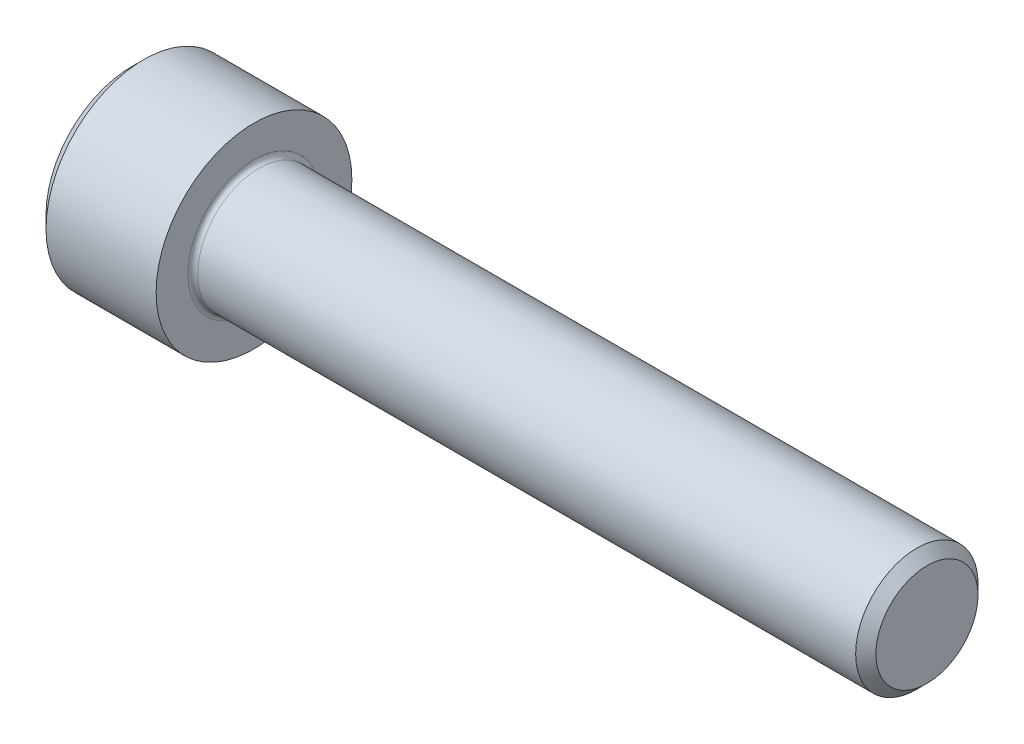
SolidWorks part; units mm, degrees
ref_plane "Plane1" through (0, 0, 0) normal (0, 0, 1) x (1, 0, 0)
ref_plane "Plane2" through (0, 0, 0) normal (0, 1, 0) x (1, 0, 0)
ref_plane "Plane3" through (0, 0, 0) normal (1, 0, 0) x (0, 0, -1)
revolve "Base-Revolve" add sketch "BodySke"
sketch "BodySke" plane through (0, 0, 0) normal (0, 0, 1) x (1, 0, 0)
  line L0 (0, 0) -> (0, 7)
  line L1 (1, 8) -> (10, 8)
  line L2 (10, 8) -> (10, 5)
  line L3 (10, 5) -> (64.172, 5)
  line L4 (65, 4.172) -> (65, 0)
  line L5 (65, 0) -> (0, 0)
  line L6 (-31.75, 0) -> (127, 0) construction
  line L7 (0, 7) -> (1, 8)
  line L8 (65, 4.172) -> (64.172, 5)
  line L9 (0, -7) -> (1, -8) construction
  line L10 (65, -4.172) -> (64.172, -5) construction
  line L11 (11.5, 9.525) -> (11.5, 3.175) construction
  line L12 (33, 9.525) -> (33, 3.175) construction
  line L13 (15, 9.525) -> (15, 3.175) construction
  dimension "Diameter" = 10
  dimension "Head_ht" = 10
  dimension "Length" = 55
  dimension "Body_ch_ang" = 45
  dimension "Head_dia" = 16
  dimension "Head_ch_ang" = 45
  dimension "Minor_dia" = 8.344
  dimension "Advance" = 1.5
  dimension "Thread_nom" = 32
  dimension "Thread_length" = 50
  dimension "Head_ch_ht" = 1
fillet "Fillet1" radius 0.4 1 edges at (10, 0, 5)
sketch "Sketch2" plane through (0, 0, 0) normal (0, 0, 1) x (1, 0, 0)
  line L0 (0, 4.0575) -> (5, 4.0575)
  line L1 (5, 4.0575) -> (7.3426, 0)
  line L2 (-31.75, 0) -> (127, 0) construction
  line L3 (7.3426, 0) -> (0, 0)
  line L4 (0, 0) -> (0, 4.0575)
  line L5 (0, 7) -> (0, -7) construction
  line L6 (0, 0) -> (47.625, 0) construction
  line L7 (10, -8) -> (10, 8) construction
  dimension "D1" = 4.0575
  dimension "D2" = 60
  dimension "Wall_thickness" = 5
revolve "Hex-PreBroach" cut sketch "Sketch2" angle 360 about L6
sketch "Sketch3" plane through (0, 0, 0) normal (-1, 0, 0) x (0, 0.5, 0.866)
  line L0 (2.3426, 4.0575) -> (-2.3426, 4.0575)
  line L1 (-2.3426, 4.0575) -> (-4.6852, 0)
  line L2 (2.3426, 4.0575) -> (4.6852, 0)
  line L3 (2.3426, -4.0575) -> (4.6852, 0)
  line L4 (2.3426, -4.0575) -> (-2.3426, -4.0575)
  line L5 (-2.3426, -4.0575) -> (-4.6852, 0)
  dimension "D1" = 4.0575
  dimension "D2" = 4.0575
  dimension "Hex_size" = 8.115
extrude "Hex" cut sketch "Sketch3" against normal blind 5
sketch "Sketch4" plane through (0, 0, 0) normal (-1, 0, 0) x (0, 0, 1)
  line L0 (0, 0) -> (3.7846, 0)
  line L1 (0, 0) -> (6.1484, 3.5498) construction
  line L2 (0, 0) -> (1.8923, 3.2776)
  line L3 (3.1235, 0.8061) -> (3.6229, 1.0945)
  line L4 (2.2599, 2.3019) -> (2.7593, 2.5903)
  arc A0 (3.1235, 0.8061) -> (2.2599, 2.3019) centre (0, 0) ccw
  arc A1 (3.7846, 0) -> (3.6229, 1.0945) centre (0, 0) ccw
  arc A2 (1.8923, 3.2776) -> (2.7593, 2.5903) centre (0, 0) cw
  dimension "D1" = 30
  dimension "Spline_n_dim" = 6.4516
  dimension "Spline_m_dim" = 7.5692
  dimension "D2" = 60
  dimension "D3" = 0.8636
  dimension "Spline_p_dim" = 1.7272
extrude "Spline" [suppressed] cut sketch "Sketch4" against normal blind 5
pattern_circular "CirPattern1" [suppressed] count 6 every 60
sketch "Sketch5" plane through (0, 0, 0) normal (0, 0, 1) x (1, 0, 0)
  line L0 (-31.75, 0) -> (127, 0) construction
  line L2 (0, 7) -> (0, -7) construction
  circle A0 centre (3.3, 0) radius 0.825
  dimension "Drilled_hole_dia" = 1.65
  dimension "Drilled_hole_loc" = 3.3
extrude "Hole" [suppressed] cut sketch "Sketch5" against normal through all and the other way through all
pattern_circular "Drilled-4" [suppressed] count 2 every 60
pattern_circular "Drilled-6" [suppressed] count 3 every 60
sketch "ThdSchSke" plane through (0, 0, 0) normal (0, 0, 1) x (1, 0, 0)
  line L0 (33, -4.172) -> (32.4202, -5)
  line L1 (33, -4.172) -> (33.5798, -5)
  line L2 (33.5798, -5) -> (33.5798, -6.25)
  line L3 (-3.175, 0) -> (5.1513, 0) construction
  line L5 (33.5798, -6.25) -> (32.4202, -6.25)
  line L6 (32.4202, -6.25) -> (32.4202, -5)
  line L7 (0, 7) -> (0, -7) construction
  dimension "Thread_minor" = 8.344
  dimension "Diameter" = 10
  dimension "Start" = 33
  dimension "SideAngle" = 55
  dimension "VeeAngle" = 70
  dimension "Overcut" = 12.5
revolve "ThreadSchematic" [suppressed] cut sketch "ThdSchSke" angle 360 about L3
pattern_linear "ThdSchPat" [suppressed]
equation "\"D2@Sketch3\" = \"Hex_size@Sketch3\" / 2"
equation "\"D1@Sketch3\" = \"Hex_size@Sketch3\" / 2"
equation "\"D1@Sketch2\" = \"Hex_size@Sketch3\" / 2"
equation "\"D3@Sketch4\" = \"Spline_p_dim@Sketch4\" / 2"
equation "\"Thread_minor@ThreadCosmetic\"  =  \"Minor_dia@BodySke\""
equation "\"D2@CirPattern1\" = 360 / \"Num_teeth@CirPattern1\""
equation "\"Wall_thickness@Sketch2\" = \"Head_ht@BodySke\" - \"Key_eng@Hex\""
equation "\"Thread_length@ThreadCosmetic\" = ((sgn( (\"Length@BodySke\" - \"Advance@BodySke\" ) - \"Thread_nom@BodySke\" )-1)*( (\"Length@BodySke\" - \"Advance@BodySke\" ) - \"Thread_nom@BodySke\" ))/-2+ \"Thread_nom@BodySke\""
equation "\"Thread_minor@ThdSchSke\" = \"Minor_dia@BodySke\""
equation "\"Diameter@ThdSchSke\" = \"Diameter@BodySke\""
equation "\"Overcut@ThdSchSke\" = \"Diameter@BodySke\" * 1.25"
equation "\"Start@ThdSchSke\" = \"Head_ht@BodySke\" + \"Length@BodySke\" - \"Thread_length@ThreadCosmetic\"  '---Non-countersunk---"
equation "\"Num_threads@ThdSchPat\" = int( \"Thread_length@ThreadCosmetic\" / \"Advance@BodySke\" + 0.999 )  + 1"
equation "\"Advance@ThdSchPat\" = \"Thread_length@ThreadCosmetic\" /  (\"Num_threads@ThdSchPat\" - 1) 'relax it"
equation "\"Num_threads@ThdSchPat\" = \"Num_threads@ThdSchPat\" - sgn( \"Num_threads@ThdSchPat\" - 1) '---chamfered tips only---"
